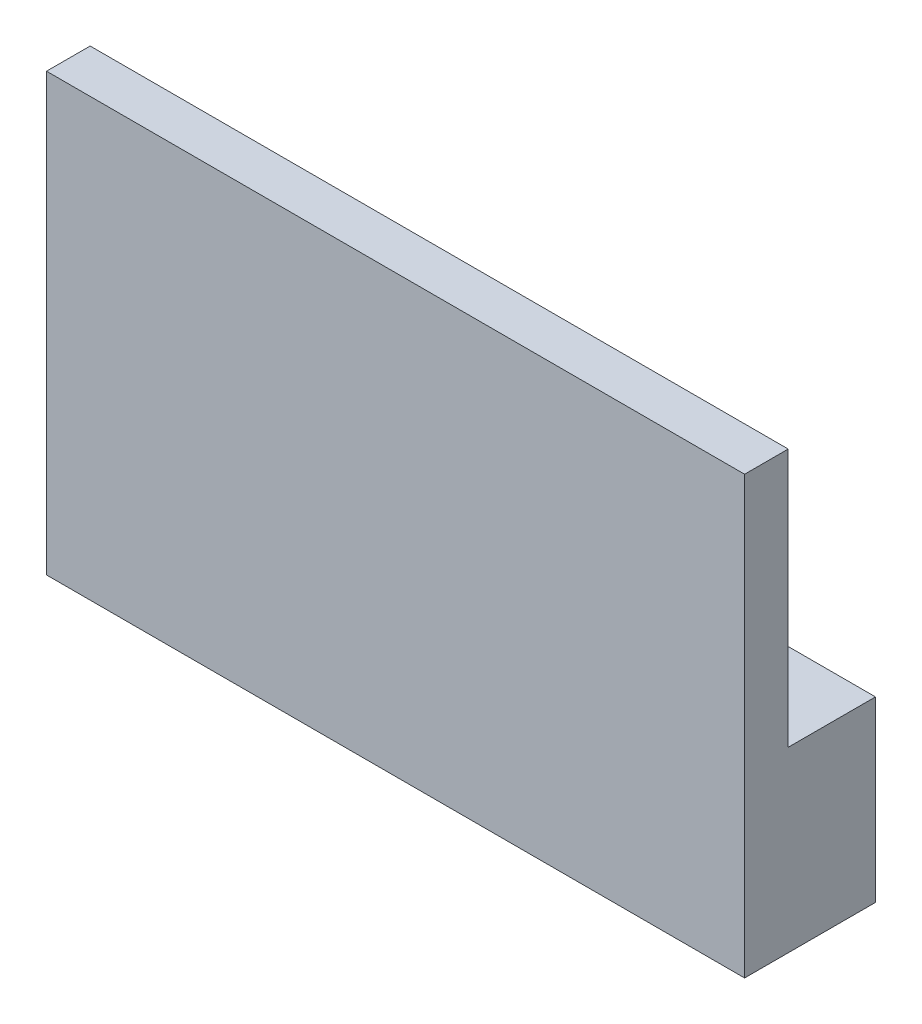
SolidWorks part; units mm, degrees
ref_plane "Front Plane" through (0, 0, 0) normal (0, 0, 1) x (1, 0, 0)
ref_plane "Top Plane" through (0, 0, 0) normal (0, 1, 0) x (1, 0, 0)
ref_plane "Right Plane" through (0, 0, 0) normal (1, 0, 0) x (0, 0, -1)
sketch "Sketch2" plane through (0, 0, 0) normal (0, 0, 1) x (1, 0, 0)
  line L1 (0, 0) -> (50.8, 0)
  line L2 (0, 0) -> (0, 31.75)
  line L3 (0, 31.75) -> (50.8, 31.75)
  line L4 (50.8, 0) -> (50.8, 31.75)
  dimension "D1" = 50.8
  dimension "D2" = 31.75
extrude "Boss-Extrude1" add sketch "Sketch2" along normal blind 3.175
sketch "Sketch4" plane through (0, 0, 0) normal (0, 0, -1) x (-1, 0, 0)
  line L0 (0, 31.75) -> (0, 0) construction
  line L1 (-50.8, 0) -> (0, 0)
  line L2 (-50.8, 0) -> (-50.8, 12.954)
  line L3 (-50.8, 12.954) -> (0, 12.954)
  line L4 (0, 0) -> (0, 12.954)
  dimension "D1" = 12.954
extrude "Boss-Extrude3" add sketch "Sketch4" along normal blind 6.35
